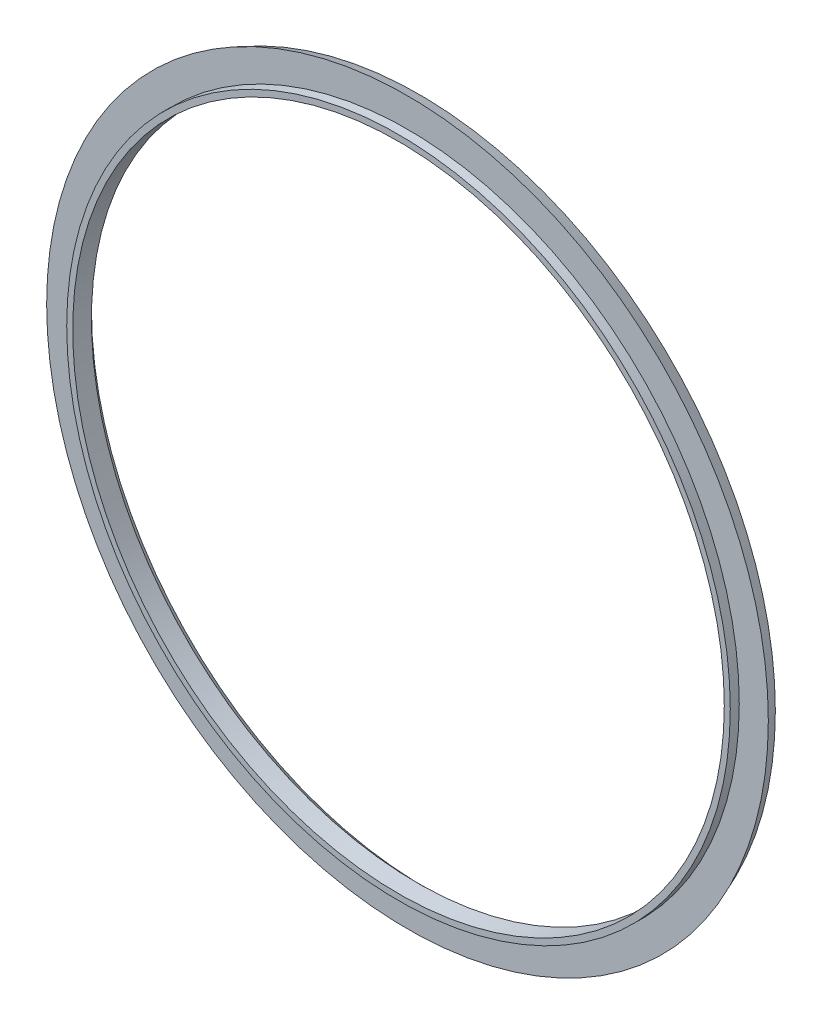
SolidWorks part; units mm, degrees
ref_plane "Front" through (0, 0, 0) normal (0, 0, 1) x (1, 0, 0)
ref_plane "Top" through (0, 0, 0) normal (0, 1, 0) x (1, 0, 0)
ref_plane "Right" through (0, 0, 0) normal (1, 0, 0) x (0, 0, -1)
sketch "Sketch1" plane through (0, 0, 0) normal (1, 0, 0) x (0, 0, -1)
  line L0 (35.6834, 95.1276) -> (42.0334, 92.4973) construction
  line L2 (38.8584, 87.8389) -> (36.4771, 87.8389)
  line L3 (36.4771, 87.8389) -> (36.4771, 86.2514)
  line L4 (0, 0) -> (55.8414, 0)
  line L6 (38.8584, 93.8124) -> (38.8584, -120.6078) construction
  line L7 (38.8584, 95.5307) -> (38.8584, 87.8389)
  line L8 (36.4771, 86.2514) -> (41.4353, 86.2514)
  line L10 (42.0334, 94.2156) -> (42.0334, 90.7507)
  line L11 (42.0334, 94.2156) -> (38.8584, 95.5307)
  line L14 (35.6834, 95.1276) -> (35.6834, -95.1276) construction
  line L15 (42.0334, 92.4973) -> (42.0334, -92.4973) construction
  line L17 (42.0334, 90.7507) -> (43.6082, 89.9483)
  line L18 (43.6082, 89.9483) -> (43.6082, 88.4243)
  line L19 (43.6082, 88.4243) -> (41.4353, 86.2514)
  line L20 (33.0799, 87.8897) -> (38.8584, 87.8897) construction
  arc A0 (0, -100.0125) -> (0, 100.0125) centre (0, 0) ccw construction
  dimension "D5" = 1.524
  dimension "D1" = 0.7937
  dimension "D2" = 1.5875
  dimension "D3" = 63
  dimension "D4" = 0.0508
  dimension "D6" = 45
  dimension "D7" = 1.5748
  dimension "D8" = 1.5875
revolve "Revolve1" add sketch "Sketch1" angle 360 about L4
